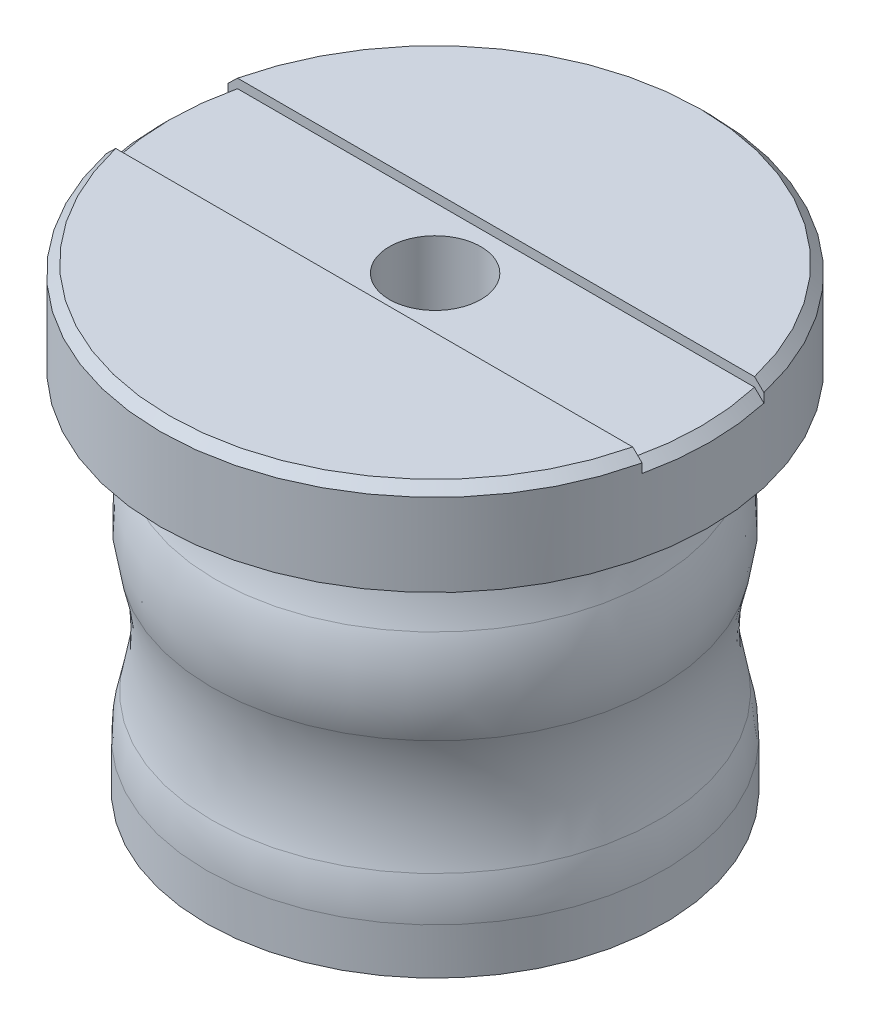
SolidWorks part; units mm, degrees
ref_plane "Front" through (0, 0, 0) normal (0, 0, 1) x (1, 0, 0)
ref_plane "Top" through (0, 0, 0) normal (0, 1, 0) x (1, 0, 0)
ref_plane "Right" through (0, 0, 0) normal (1, 0, 0) x (0, 0, -1)
sketch "Sketch1" plane through (0, 0, 0) normal (0, 1, 0) x (1, 0, 0)
  circle A0 centre (0, 0) radius 3
  dimension "D1" = 6
extrude "Boss-Extrude1" add sketch "Sketch1" along normal blind 1
sketch "Sketch5" plane through (0, 1, 0) normal (0, 1, 0) x (1, 0, 0)
  line L1 (-4.25, -0.665) -> (4.25, -0.665)
  line L2 (-4.25, -0.665) -> (-4.25, 0.665)
  line L3 (-4.25, 0.665) -> (4.25, 0.665)
  line L4 (4.25, -0.665) -> (4.25, 0.665)
  line L5 (-4.25, -0.665) -> (4.25, 0.665) construction
  line L6 (-4.25, 0.665) -> (4.25, -0.665) construction
  point P0 (0, 0)
  dimension "D1" = 8.5
  dimension "D2" = 1.33
extrude "Cut-Extrude1" cut sketch "Sketch5" against normal blind 0.1
sketch "Sketch3" plane through (0, 0, 0) normal (0, 0, 1) x (1, 0, 0)
  line L0 (0, 0) -> (-2.25, 0)
  line L1 (0, 0) -> (-2.5, 0) construction
  line L2 (0, 0) -> (0, -4) construction
  line L3 (0, -4) -> (-2.5, -4) construction
  line L4 (-2.5, 0) -> (-2.5, -4) construction
  line L5 (-2.5, -4) -> (0, -4)
  line L6 (0, -4) -> (0, 0)
  arc A0 (-2.25, 0) -> (-2.397, -0.8) centre (-4.5, 0) cw
  arc A1 (-2.397, -0.8) -> (-2.4374, -1.8) centre (-0.9241, -1.3603) ccw
  arc A2 (-2.4374, -1.8) -> (-2.4374, -3.0556) centre (-4.5981, -2.4278) cw
  arc A3 (-2.4374, -3.0556) -> (-2.5, -3.4967) centre (-0.9241, -3.4953) ccw
  arc A4 (-2.5, -3.4967) -> (-2.5, -4) centre (-287.4999, -3.748) cw
  dimension "D6" = 2.25
  dimension "D7" = 285
  dimension "D1" = 2.5
  dimension "D2" = 4
  dimension "D3" = 0.25
  dimension "D4" = 0.8
  dimension "D5" = 1
revolve "Revolve1" add sketch "Sketch3" angle 360 about axis through (0, 1, 0) along (0, -1, 0)
sketch "Sketch6" plane through (0, 0.9, 0) normal (0, 1, 0) x (1, 0, 0)
  circle A0 centre (0, 0) radius 0.5
  dimension "D1" = 1
extrude "Cut-Extrude4" cut sketch "Sketch6" against normal through all
shell "Shell5" thickness 0.5
chamfer "Chamfer1" distance 0.1 angle 45 4 edges at (3, 0.9, 0) (-3, 0.9, 0) (0, 1, 3) (0, 1, -3)
